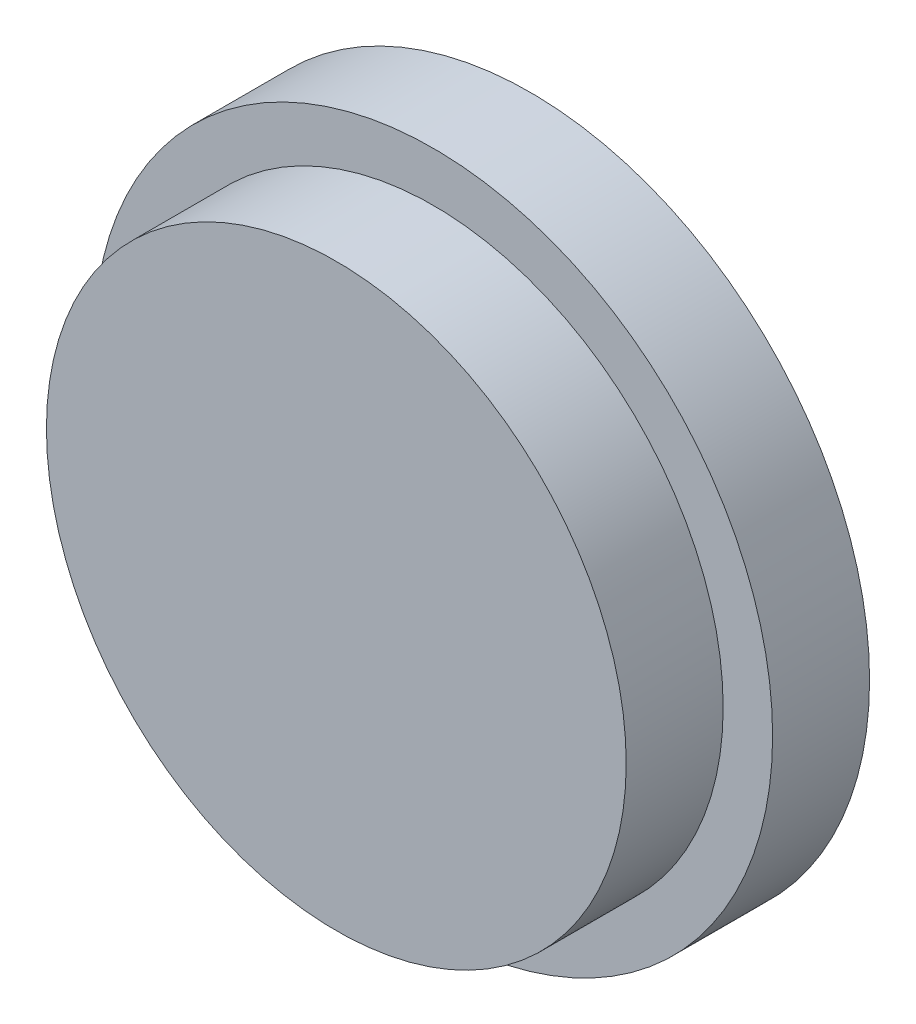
SolidWorks part; units mm, degrees
ref_plane "Front Plane" through (0, 0, 0) normal (0, 0, 1) x (1, 0, 0)
ref_plane "Top Plane" through (0, 0, 0) normal (0, 1, 0) x (1, 0, 0)
ref_plane "Right Plane" through (0, 0, 0) normal (1, 0, 0) x (0, 0, -1)
sketch "Sketch1" plane through (0, 0, 0) normal (0, 0, 1) x (1, 0, 0)
  circle A0 centre (0, 0) radius 44.45
  dimension "D1" = 88.9
extrude "Boss-Extrude1" add sketch "Sketch1" along normal blind 12.7
sketch "Sketch2" plane through (0, 0, 12.7) normal (0, 0, 1) x (1, 0, 0)
  circle A0 centre (0, 0) radius 37.973
  dimension "D1" = 75.946
extrude "Boss-Extrude2" add sketch "Sketch2" along normal blind 12.7
